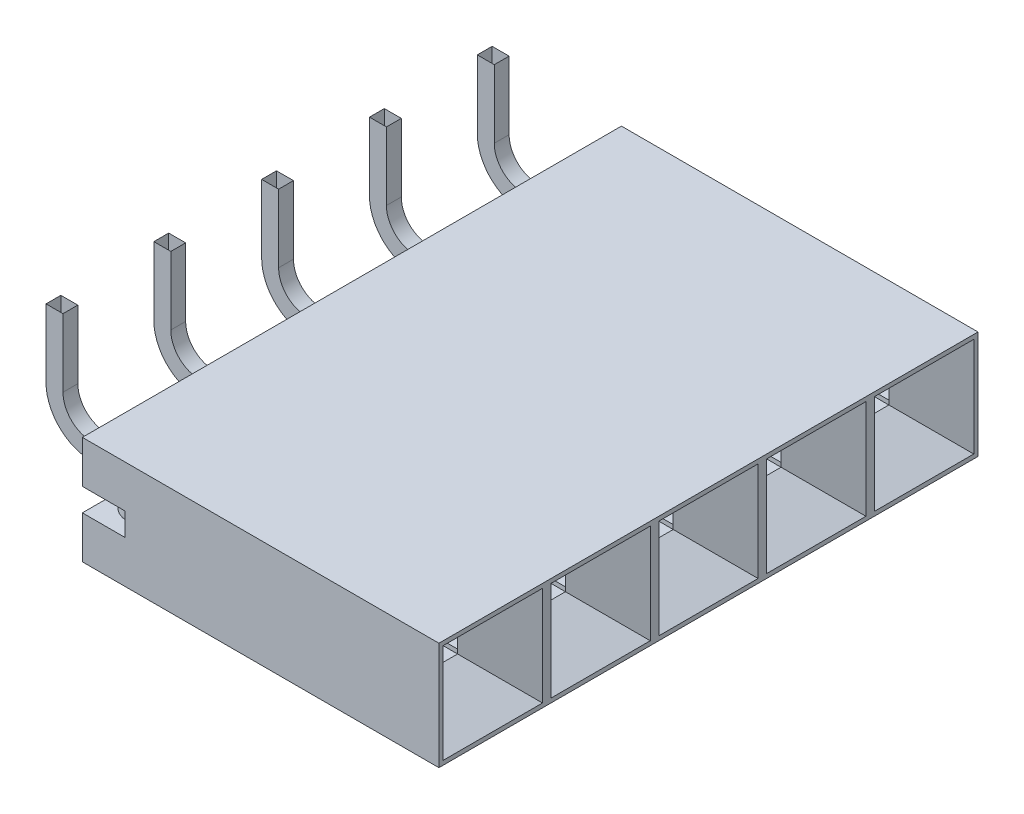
SolidWorks part; units mm, degrees
ref_plane "Plan de face" through (0, 0, 0) normal (0, 0, 1) x (1, 0, 0)
ref_plane "Plan de dessus" through (0, 0, 0) normal (0, 1, 0) x (1, 0, 0)
ref_plane "Plan de droite" through (0, 0, 0) normal (1, 0, 0) x (0, 0, -1)
imported_body "FrameAndPin_H254_90deg-1/frame_H254-1-surface1"
imported_body "FrameAndPin_H254_90deg-1/pin-90deg-1-surface1"
imported_body "FrameAndPin_H254_90deg-2/frame_H254-1-surface1"
imported_body "FrameAndPin_H254_90deg-2/pin-90deg-1-surface1"
imported_body "FrameAndPin_H254_90deg-4/frame_H254-1-surface1"
imported_body "FrameAndPin_H254_90deg-4/pin-90deg-1-surface1"
imported_body "FrameAndPin_H254_90deg-5/frame_H254-1-surface1"
imported_body "FrameAndPin_H254_90deg-5/pin-90deg-1-surface1"
imported_body "FrameAndPin_H254_90deg-6/frame_H254-1-surface1"
imported_body "FrameAndPin_H254_90deg-6/pin-90deg-1-surface1"
surface "Surface-Cousue1"
sketch "Esquisse1" plane through (0, 0, 0) normal (1, 0, 0) x (0, 0, -1)
  line L0 (-2.54, 2.54) -> (10.16, 2.54) construction
  line L1 (-5.8283, 8.9576) -> (12.6126, 8.9576)
  line L2 (-5.8283, 8.9576) -> (-5.8283, 3.74)
  line L3 (-5.8283, 3.74) -> (12.6126, 3.74)
  line L4 (12.6126, 8.9576) -> (12.6126, 3.74)
  dimension "D1" = 1.2
split "Fractionner1" resulting bodies 117 118 119 120 121
